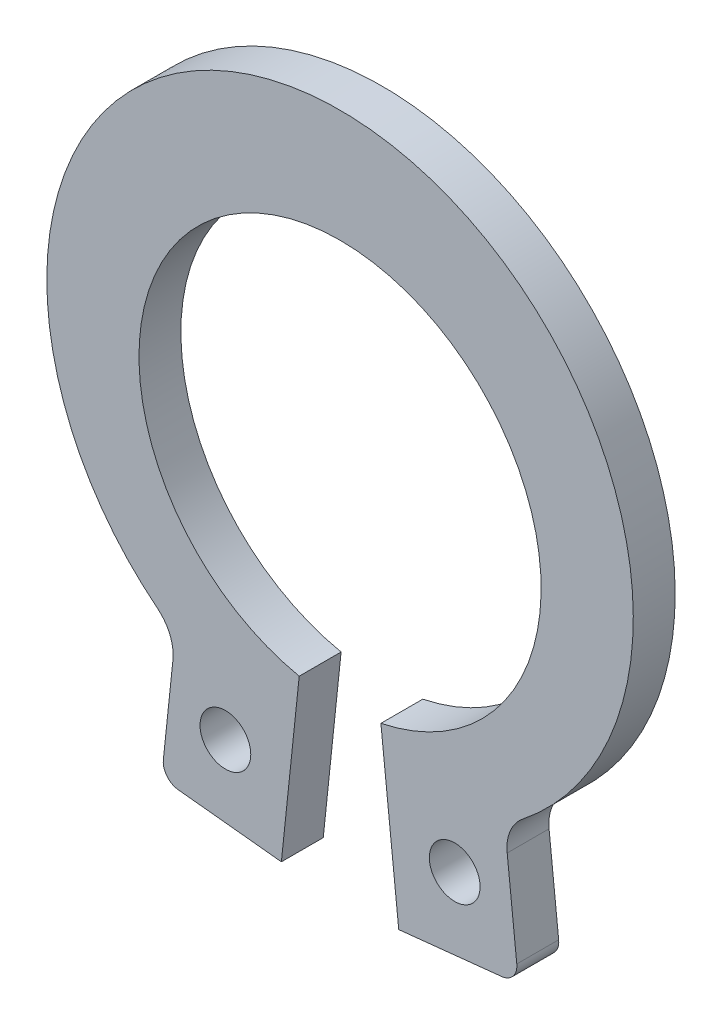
SolidWorks part; units mm, degrees
ref_plane "Face" through (0, 0, 0) normal (0, 0, 1) x (1, 0, 0)
ref_plane "Dessus" through (0, 0, 0) normal (0, 1, 0) x (1, 0, 0)
ref_plane "Droite" through (0, 0, 0) normal (1, 0, 0) x (0, 0, -1)
sketch "Esquisse1" plane through (0, 0, 0) normal (0, 0, 1) x (1, 0, 0)
  line L0 (-1.4008, -8.7513) -> (-0.9749, -4.6999)
  line L1 (-3.8627, -8.4925) -> (-1.4008, -8.7513)
  line L2 (-3.9896, -5.8729) -> (-4.2187, -8.0529)
  line L3 (3.9896, -5.8729) -> (4.2187, -8.0529)
  line L4 (3.8627, -8.4925) -> (1.4008, -8.7513)
  line L5 (1.4008, -8.7513) -> (0.9749, -4.6999)
  line L6 (0, -9.4684) -> (0, 7.0077) construction
  arc A0 (0.9749, -4.6999) -> (-0.9749, -4.6999) centre (0, 0) ccw
  arc A1 (-4.2187, -8.0529) -> (-3.8627, -8.4925) centre (-3.8209, -8.0947) ccw
  arc A2 (-4.3611, -4.9861) -> (-3.9896, -5.8729) centre (-4.9841, -5.7684) cw
  arc A3 (-4.3611, -4.9861) -> (4.3611, -4.9861) centre (0, 0.4893) cw
  arc A4 (4.3611, -4.9861) -> (3.9896, -5.8729) centre (4.9841, -5.7684) ccw
  arc A5 (4.2187, -8.0529) -> (3.8627, -8.4925) centre (3.8209, -8.0947) cw
  dimension "D1" = 4.8
  dimension "D2" = 7
extrude "Base-Extrusion" add sketch "Esquisse1" along normal blind 1
sketch "Esquisse2" plane through (0, 0, 0) normal (0, 0, 1) x (1, 0, 0)
  line L2 (0, 2.8667) -> (0, -8.2992) construction
  arc A0 (2.5424, -6.3226) -> (2.4945, -7.4516) centre (2.737, -6.8964) cw
  arc A1 (2.4945, -7.4516) -> (2.5424, -6.3226) centre (2.737, -6.8964) cw
  arc A2 (-2.4945, -7.4516) -> (-2.5424, -6.3226) centre (-2.737, -6.8964) ccw
  arc A3 (-2.5424, -6.3226) -> (-2.4945, -7.4516) centre (-2.737, -6.8964) ccw
extrude "Enlèv. mat.-Extru.1" cut sketch "Esquisse2" along normal blind 1
